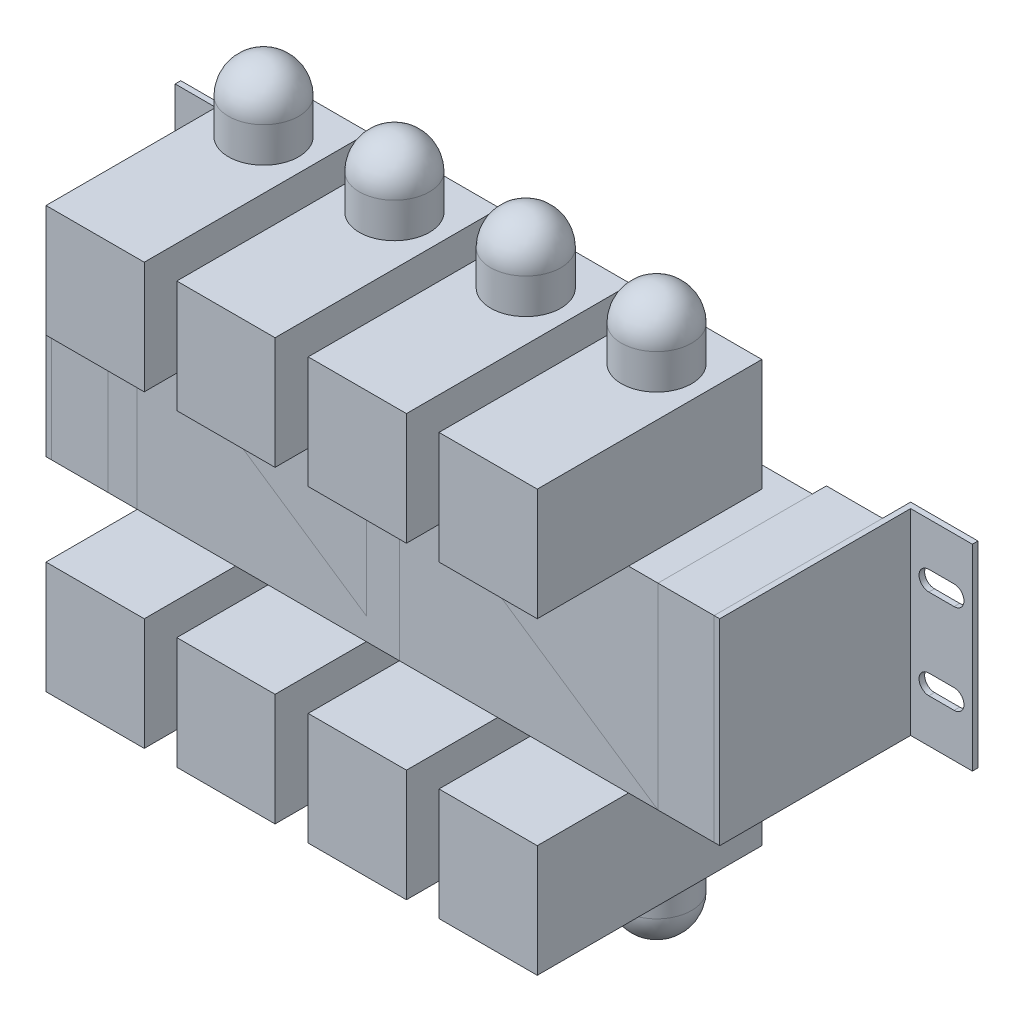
SolidWorks part; units mm, degrees
ref_plane "Plan de face" through (0, 0, 0) normal (0, 0, 1) x (1, 0, 0)
ref_plane "Plan de dessus" through (0, 0, 0) normal (0, 1, 0) x (1, 0, 0)
ref_plane "Plan de droite" through (0, 0, 0) normal (1, 0, 0) x (0, 0, -1)
sketch "Esquisse1" plane through (0, 0, 0) normal (0, 0, 1) x (1, 0, 0)
  line L0 (-98, 35) -> (98, -35) construction
  line L1 (-98, 35) -> (98, 35)
  line L2 (-98, 35) -> (-98, -35)
  line L3 (-98, -35) -> (98, -35)
  line L4 (98, 35) -> (98, -35)
  dimension "D1" = 196
  dimension "D2" = 70
extrude "Extrusion1" add sketch "Esquisse1" along normal blind 55
sketch "Esquisse2" plane through (98, 0, 0) normal (1, 0, 0) x (0, 0, -1)
  line L0 (-55, -35) -> (0, -35) construction
  line L1 (-55, 35) -> (5, 35)
  line L2 (-55, 35) -> (-55, -35)
  line L3 (-55, -35) -> (5, -35)
  line L4 (5, 35) -> (5, -35)
  dimension "D1" = 60
extrude "Extrusion2" add sketch "Esquisse2" along normal blind 20 separate body
sketch "Esquisse3" plane through (0, 35, 0) normal (0, 1, 0) x (-1, 0, 0)
  line L0 (-118, 55) -> (-118, -15)
  line L1 (-118, -15) -> (-142, -15)
  line L2 (-142, -15) -> (-142, -13)
  line L3 (-142, -13) -> (-120, -13)
  line L4 (-120, -13) -> (-120, 55)
  line L5 (-120, 55) -> (-118, 55)
  dimension "D1" = 24
  dimension "D2" = 70
  dimension "D3" = 2
extrude "Extrusion3" add sketch "Esquisse3" against normal up to vertex (70 mm away) separate body
sketch "Esquisse4" plane through (0, 0, -13) normal (0, 0, 1) x (1, 0, 0)
  line L0 (126.5, 19.5) -> (135.5, 19.5)
  line L1 (142, -35) -> (142, 35) construction
  line L2 (135.5, 12.5) -> (126.5, 12.5)
  line L3 (120, 35) -> (142, 35) construction
  arc A0 (126.5, 19.5) -> (126.5, 12.5) centre (126.5, 16) ccw
  arc A1 (135.5, 12.5) -> (135.5, 19.5) centre (135.5, 16) ccw
  dimension "D1" = 16
  dimension "D3" = 3
  dimension "D2" = 7
  dimension "D4" = 15.5
extrude "Enlèv. mat.-Extru.1" cut sketch "Esquisse4" against normal through all
mirror "Symétrie1" about plane through (0, 0, 0) normal (0, 1, 0) of "Enlèv. mat.-Extru.1"
ref_plane "Plan1" through (46.7, 0, 0) normal (1, 0, 0) x (0, 0, -1)
sketch "Esquisse6" plane through (0, 35, 0) normal (0, 1, 0) x (-1, 0, 0)
  line L0 (-98, 0) -> (98, 0) construction
  line L1 (-87.5, 87.5) -> (-52.5, 87.5)
  line L2 (-87.5, 87.5) -> (-87.5, 7.5)
  line L3 (-87.5, 7.5) -> (-52.5, 7.5)
  line L4 (-52.5, 87.5) -> (-52.5, 7.5)
  dimension "D1" = 35
  dimension "D2" = 80
  dimension "D3" = 7.5
  dimension "D4" = 52.5
extrude "Extrusion4" add sketch "Esquisse6" along normal blind 40
ref_plane "Plan2" through (70, 0, 0) normal (1, 0, 0) x (0, 0, -1)
ref_plane "Plan3" through (0, 0, 27.5) normal (0, 0, -1) x (-1, 0, 0)
ref_axis "Axe1" through (70, 33, 27.5) along (0, 1, 0)
sketch "Esquisse7" plane through (70, 0, 0) normal (1, 0, 0) x (0, 0, -1)
  line L0 (-40, 75) -> (-40, 87.5)
  line L1 (-87.5, 75) -> (-7.5, 75) construction
  line L2 (-27.5, 100) -> (-27.5, 75)
  line L3 (-27.5, 75) -> (-40, 75)
  line L5 (-27.5, -19.25) -> (-27.5, 19.25) construction
  arc A0 (-40, 87.5) -> (-27.5, 100) centre (-27.5, 87.5) cw
  dimension "D1" = 12.5
  dimension "D2" = 25
revolve "Révolution1" add sketch "Esquisse7" angle 360 about axis through (70, 33, 27.5) along (0, 1, 0)
mirror "Symétrie2" about plane through (46.7, 0, 0) normal (1, 0, 0) of "Extrusion4", "Révolution1"
mirror "Symétrie3" about plane through (0, 0, 0) normal (0, 1, 0) of "Symétrie2", "Extrusion4", "Révolution1"
mirror "Symétrie6" about plane through (0, 0, 0) normal (1, 0, 0)
mirror "Symétrie7" about plane through (0, 0, 0) normal (1, 0, 0)
